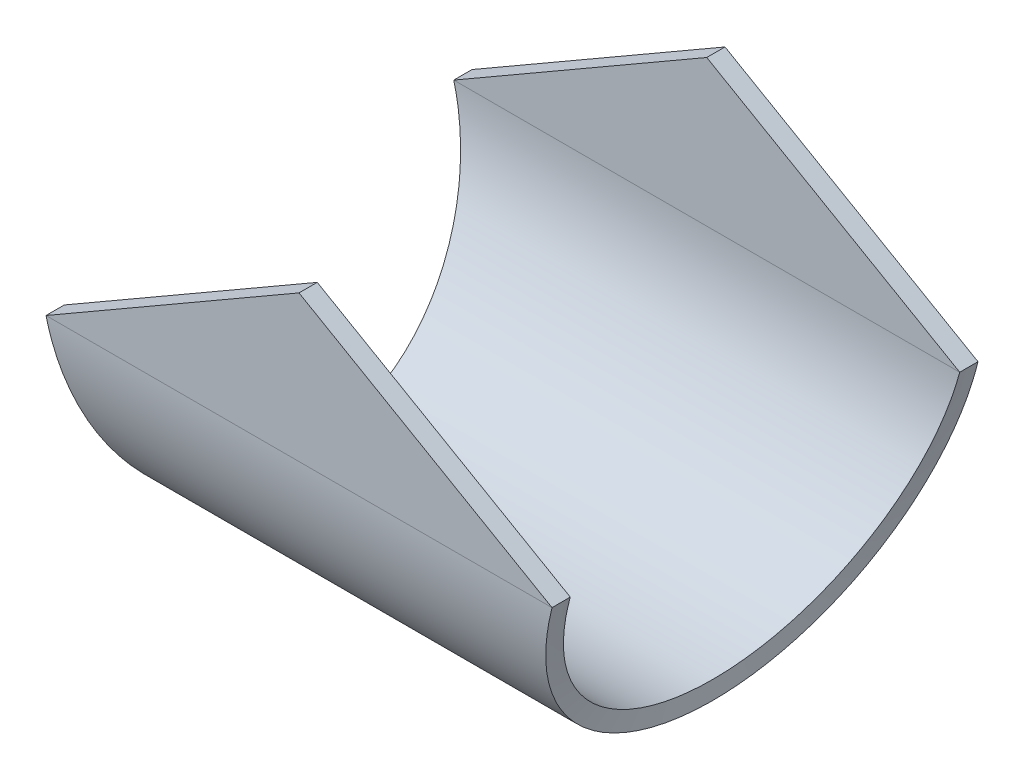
SolidWorks part; units mm, degrees
ref_plane "前视基准面" through (0, 0, 0) normal (0, 0, 1) x (1, 0, 0)
ref_plane "上视基准面" through (0, 0, 0) normal (0, 1, 0) x (1, 0, 0)
ref_plane "右视基准面" through (0, 0, 0) normal (1, 0, 0) x (0, 0, -1)
imported_body "基体零件-带补料的120°Y形三通管-1"
sheet metal parameters "钣金1" parameters "D1"=0.7366, "厚度"=1
bend "圆角折弯1" bend radius 10.6658 bend angle 180 parameters "D5"=1
flatten bends "展开-折弯1" parameters "D1"=0
sketch "尖角-草图1" plane through (0, 0, -10.6658) normal (0, 0, 1) x (1, 0, 0)
  line L0 (-13.8564, -24.7538) -> (13.8564, -24.7538) construction
process bends "加工-折弯1" parameters "D1"=0
sketch "平面-草图1" plane through (0, 0, -10.6658) normal (0, 0, 1) x (1, 0, 0)
flat pattern "平板型式1"
sketch "折弯-线1" plane through (0, 0, 0) normal (0, 1, 0) x (-1, 0, 0)
bend of the flat pattern "展开-<圆角折弯1>1"
